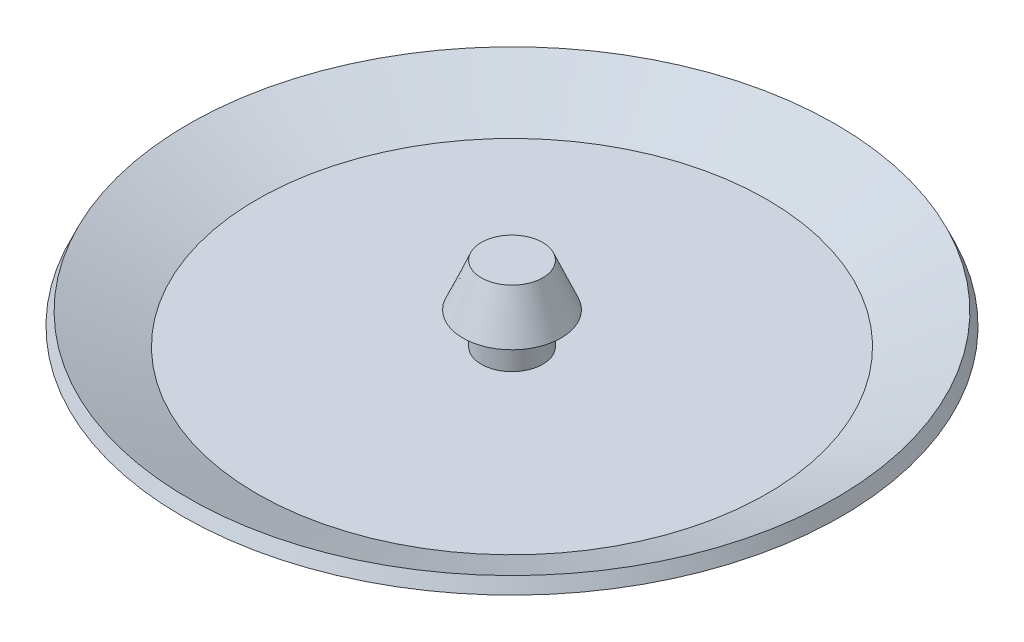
SolidWorks part; units mm, degrees
ref_plane "Front" through (0, 0, 0) normal (0, 0, 1) x (1, 0, 0)
ref_plane "Top" through (0, 0, 0) normal (0, 1, 0) x (1, 0, 0)
ref_plane "Right" through (0, 0, 0) normal (1, 0, 0) x (0, 0, -1)
sketch "Sketch2" plane through (0, 0, 0) normal (0, 0, 1) x (1, 0, 0)
  line L0 (0, 0) -> (0, 15.8342) construction
  line L1 (0, 0) -> (0, 16.3322)
  line L2 (0, 16.3322) -> (1.27, 16.3322)
  line L3 (1.27, 16.3322) -> (1.27, 3.6322)
  line L4 (1.27, 3.6322) -> (2.032, 1.8542)
  line L5 (2.032, 1.8542) -> (1.27, 1.8542)
  line L6 (1.27, 1.8542) -> (1.27, 0.5317)
  line L7 (1.27, 0.5317) -> (10.5529, 0.5317)
  line L8 (10.5529, 0.5317) -> (13.4019, 1.8017)
  line L9 (13.4019, 1.8017) -> (13.6398, 1.2681)
  line L10 (13.6398, 1.2681) -> (10.795, 0)
  line L11 (10.795, 0) -> (0, 0)
  dimension "D1" = 0.5317
  dimension "D2" = 1.27
  dimension "D3" = 13.6398
  dimension "D4" = 10.795
  dimension "D5" = 0.5842
  dimension "D6" = 1.27
  dimension "D7" = 1.27
  dimension "D8" = 2.032
  dimension "D9" = 14.478
  dimension "D10" = 16.3322
  dimension "D11" = 12.7
revolve "Base-Revolve" add sketch "Sketch2" angle 360 about L0
sketch "Sketch3" plane through (0, 0, 0) normal (0, 0, 1) x (1, 0, 0)
  line L0 (1.27, 16.3322) -> (-1.27, 16.3322) construction
  line L1 (1.27, 16.3322) -> (-1.27, 16.3322)
  line L2 (1.27, 3.6322) -> (-1.27, 3.6322) construction
  line L3 (1.27, 3.6322) -> (-1.27, 3.6322)
  line L4 (1.27, 3.6322) -> (1.27, 16.3322)
  line L5 (-1.27, 16.3322) -> (-1.27, 3.6322)
extrude "Cut-Extrude1" cut sketch "Sketch3" against normal through all and the other way through all
